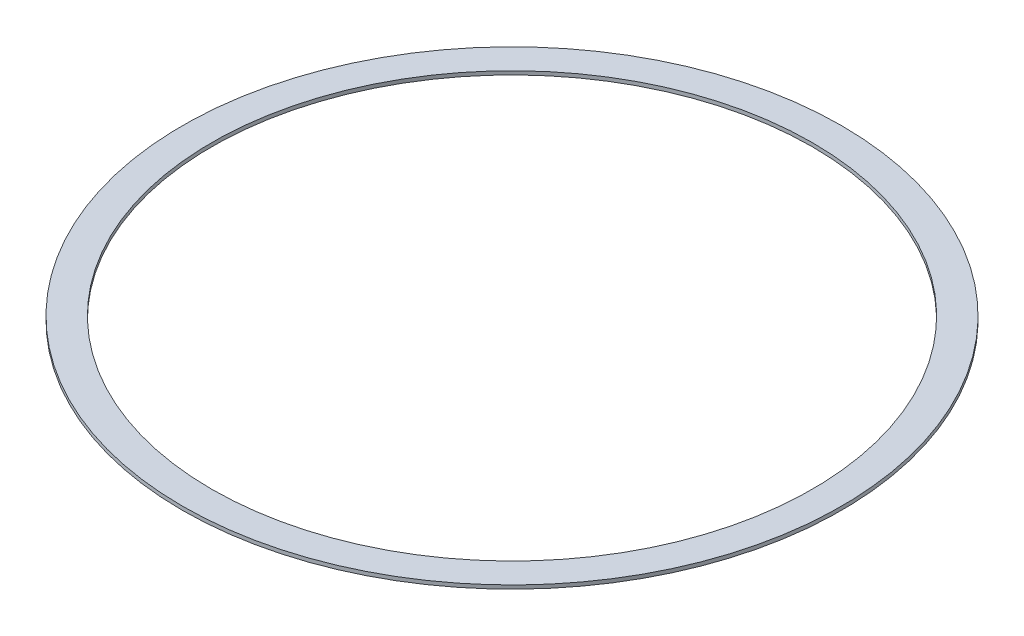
SolidWorks part; units mm, degrees
ref_plane "前视基准面" through (0, 0, 0) normal (0, 0, 1) x (1, 0, 0)
ref_plane "上视基准面" through (0, 0, 0) normal (0, 1, 0) x (1, 0, 0)
ref_plane "右视基准面" through (0, 0, 0) normal (1, 0, 0) x (0, 0, -1)
sketch "草图1" plane through (0, 0, 0) normal (0, 1, 0) x (1, 0, 0)
  circle A0 centre (0, 0) radius 45
  circle A1 centre (0, 0) radius 41
  dimension "D1" = 82
  dimension "D2" = 90
extrude "凸台-拉伸1" add sketch "草图1" along normal blind 0.5
